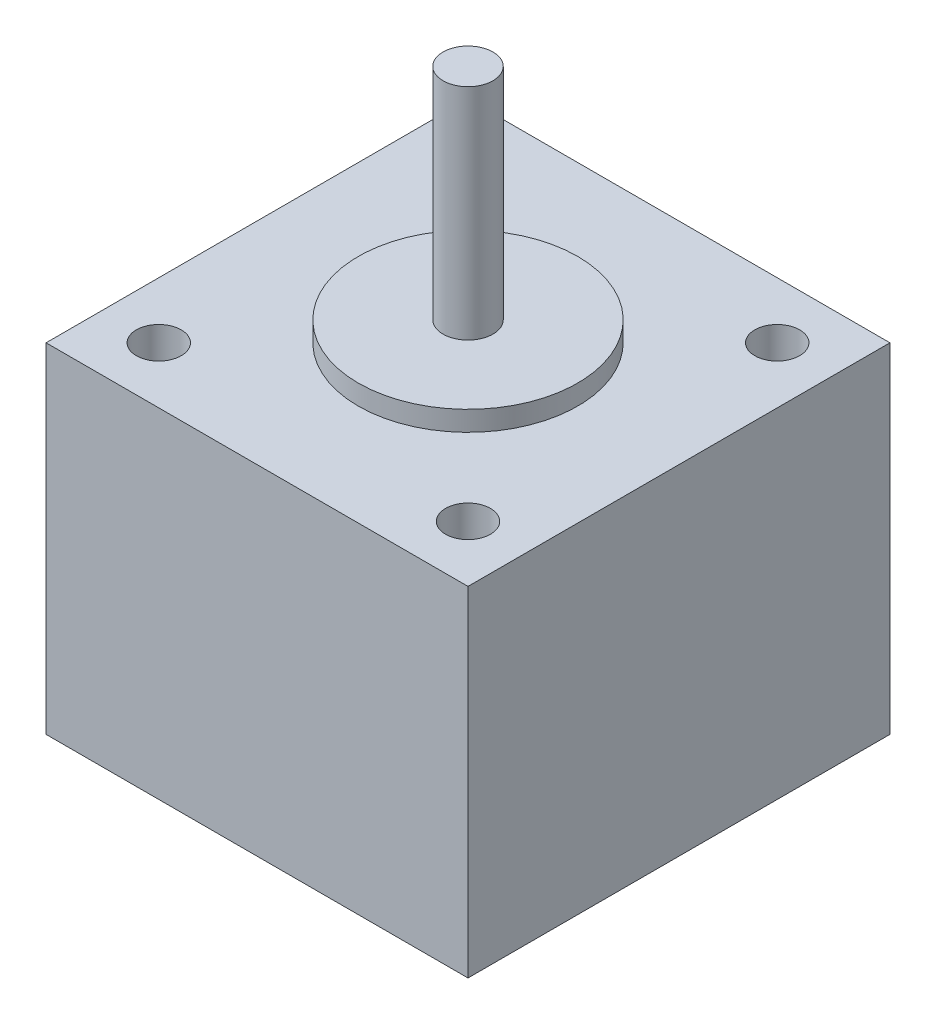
SolidWorks part; units mm, degrees
ref_plane "Front Plane" through (0, 0, 0) normal (0, 0, 1) x (1, 0, 0)
ref_plane "Top Plane" through (0, 0, 0) normal (0, 1, 0) x (1, 0, 0)
ref_plane "Right Plane" through (0, 0, 0) normal (1, 0, 0) x (0, 0, -1)
sketch "Sketch1" plane through (0, 0, 0) normal (0, 1, 0) x (1, 0, 0)
  line L1 (-75.0337, 13.738) -> (-32.7337, 13.738)
  line L2 (-75.0337, 13.738) -> (-75.0337, -28.562)
  line L3 (-75.0337, -28.562) -> (-32.7337, -28.562)
  line L4 (-32.7337, 13.738) -> (-32.7337, -28.562)
  dimension "D1" = 42.3
  dimension "D2" = 42.3
extrude "Boss-Extrude1" add sketch "Sketch1" along normal blind 34
sketch "Sketch2" plane through (0, 34, 0) normal (0, 1, 0) x (-1, 0, 0)
  line L0 (32.7337, 28.562) -> (32.7337, -13.738) construction
  line L1 (32.7337, -13.738) -> (75.0337, -13.738) construction
  circle A0 centre (53.8837, 7.412) radius 11
  point P4 (53.8837, -13.738)
  dimension "D3" = 22
  dimension "D1" = 21.15
  dimension "D2" = 21.15
extrude "Boss-Extrude2" add sketch "Sketch2" along normal blind 2
sketch "Sketch4" plane through (0, 36, 0) normal (0, 1, 0) x (-1, 0, 0)
  line L0 (32.7337, -13.738) -> (75.0337, -13.738) construction
  line L1 (75.0337, -13.738) -> (75.0337, 28.562) construction
  circle A0 centre (53.8837, 7.412) radius 2.5
  dimension "D1" = 5
  dimension "D2" = 21.15
  dimension "D3" = 21.15
extrude "Boss-Extrude3" add sketch "Sketch4" along normal blind 22
sketch "Sketch5" plane through (0, 34, 0) normal (0, 1, 0) x (-1, 0, 0)
  line L0 (32.7337, -13.738) -> (75.0337, -13.738) construction
  line L1 (75.0337, -13.738) -> (75.0337, 28.562) construction
  line L2 (32.7337, 28.562) -> (32.7337, -13.738) construction
  line L3 (75.0337, 28.562) -> (32.7337, 28.562) construction
  circle A0 centre (69.3837, -8.088) radius 2.25
  circle A1 centre (38.3837, -8.088) radius 2.25
  circle A2 centre (38.3837, 22.912) radius 2.25
  circle A3 centre (69.3837, 22.912) radius 2.25
  dimension "D1" = 4.5
  dimension "D2" = 4.5
  dimension "D3" = 4.5
  dimension "D4" = 4.5
  dimension "D9" = 5.65
  dimension "D5" = 5.65
  dimension "D6" = 5.65
  dimension "D7" = 5.65
  dimension "D8" = 5.65
  dimension "D10" = 5.65
  dimension "D11" = 5.65
  dimension "D12" = 5.65
extrude "Cut-Extrude2" cut sketch "Sketch5" against normal blind 4
